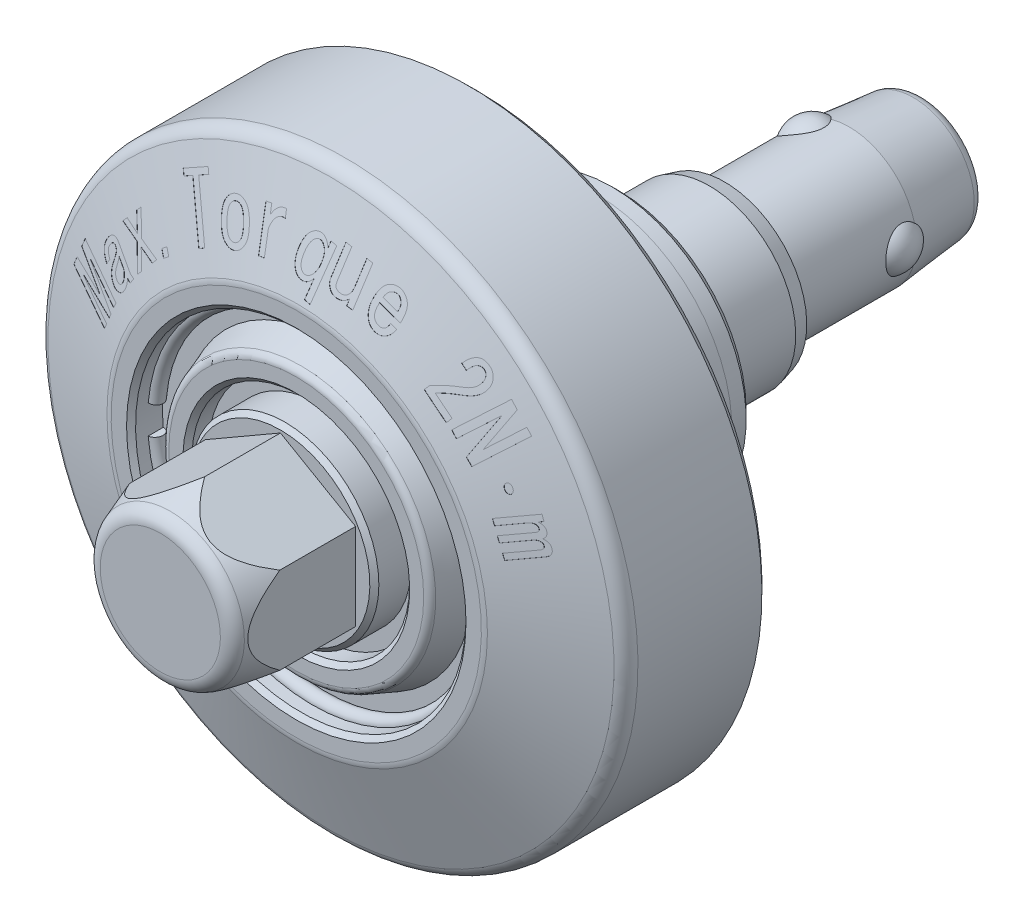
SolidWorks part; units mm, degrees
ref_plane "Front" through (0, 0, 0) normal (0, 0, 1) x (1, 0, 0)
ref_plane "Top" through (0, 0, 0) normal (0, 1, 0) x (1, 0, 0)
ref_plane "Right" through (0, 0, 0) normal (1, 0, 0) x (0, 0, -1)
imported_body "Imported1"
sketch "Sketch1" plane through (0, 0, 0) normal (1, 0, 0) x (0, 0, -1)
  line L0 (-33.1941, 0) -> (33.8765, 0) construction
  line L1 (-9.6917, 18.842) -> (-10.9081, 15.5) construction
  line L2 (-9.9799, 18.0503) -> (-11.6359, 13.5004)
  line L4 (-9.7368, 17.9618) -> (-11.3928, 13.4119)
  line L6 (-11.6359, 13.5004) -> (-11.3928, 13.4119)
  line L7 (-9.9799, 18.0503) -> (-9.7368, 17.9618)
revolve "Revolve1" add sketch "Sketch1" angle 360 about L0
sketch "Sketch8" plane through (0, 0, 12) normal (0, 0, 1) x (1, 0, 0)
  arc A0 (14, 0) -> (-14, 0) centre (0, 0) ccw construction
  text T0 "Max.Torque 2N･m" font "ＭＳ ゴシック" height in points 12
extrude "Extrude5" cut sketch "Sketch8" against normal offset from surface (1.4443 mm away) 0.01
